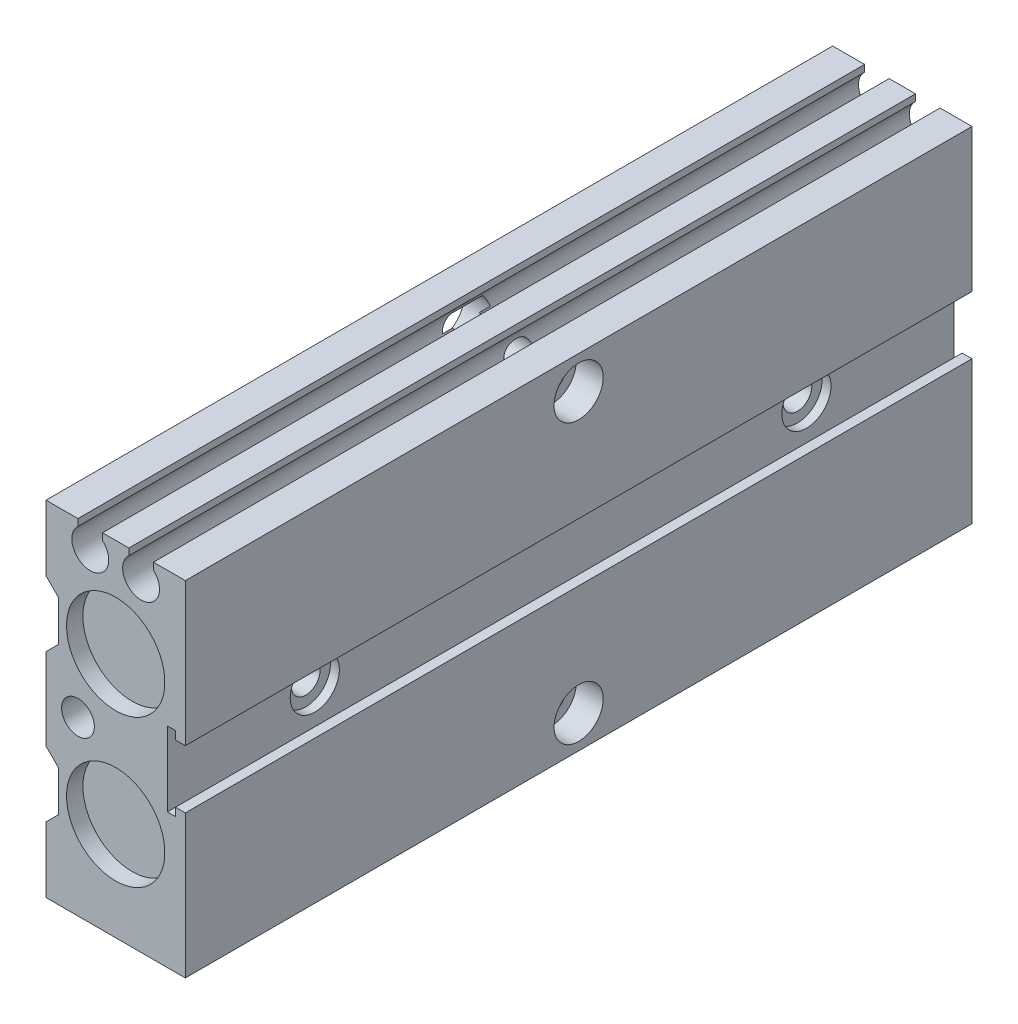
SolidWorks part; units mm, degrees
ref_plane "前视基准面" through (0, 0, 0) normal (0, 0, 1) x (1, 0, 0)
ref_plane "上视基准面" through (0, 0, 0) normal (0, 1, 0) x (1, 0, 0)
ref_plane "右视基准面" through (0, 0, 0) normal (1, 0, 0) x (0, 0, -1)
imported_body "输入1"
imported_body "输入2"
imported_body "输入3"
sketch "草图1" plane through (0, -21, 0) normal (0, -1, 0) x (1, 0, 0)
  line L1 (15.0749, -4.4482) -> (-12.2852, -4.4482)
  line L2 (15.0749, -4.4482) -> (15.0749, 63.9976)
  line L3 (15.0749, 63.9976) -> (-12.2852, 63.9976)
  line L4 (-12.2852, -4.4482) -> (-12.2852, 63.9976)
extrude "切除-拉伸1" cut sketch "草图1" against normal blind 15
sketch "草图2" plane through (0, 21, 0) normal (0, 1, 0) x (-1, 0, 0)
  line L1 (14.7773, -5.7538) -> (-8.5, -5.7538)
  line L2 (14.7773, -5.7538) -> (14.7773, 64)
  line L3 (14.7773, 64) -> (-8.5, 64)
  line L4 (-8.5, -5.7538) -> (-8.5, 64)
extrude "切除-拉伸2" cut sketch "草图2" against normal blind 15
sketch "草图3" plane through (0, 6, 0) normal (0, 1, 0) x (-1, 0, 0)
  line L1 (23.8571, -8.4944) -> (-37.751, -8.4944)
  line L2 (23.8571, -8.4944) -> (23.8571, 16.8781)
  line L3 (23.8571, 16.8781) -> (-37.751, 16.8781)
  line L4 (-37.751, -8.4944) -> (-37.751, 16.8781)
extrude "切除-拉伸3" cut sketch "草图3" against normal blind 15
